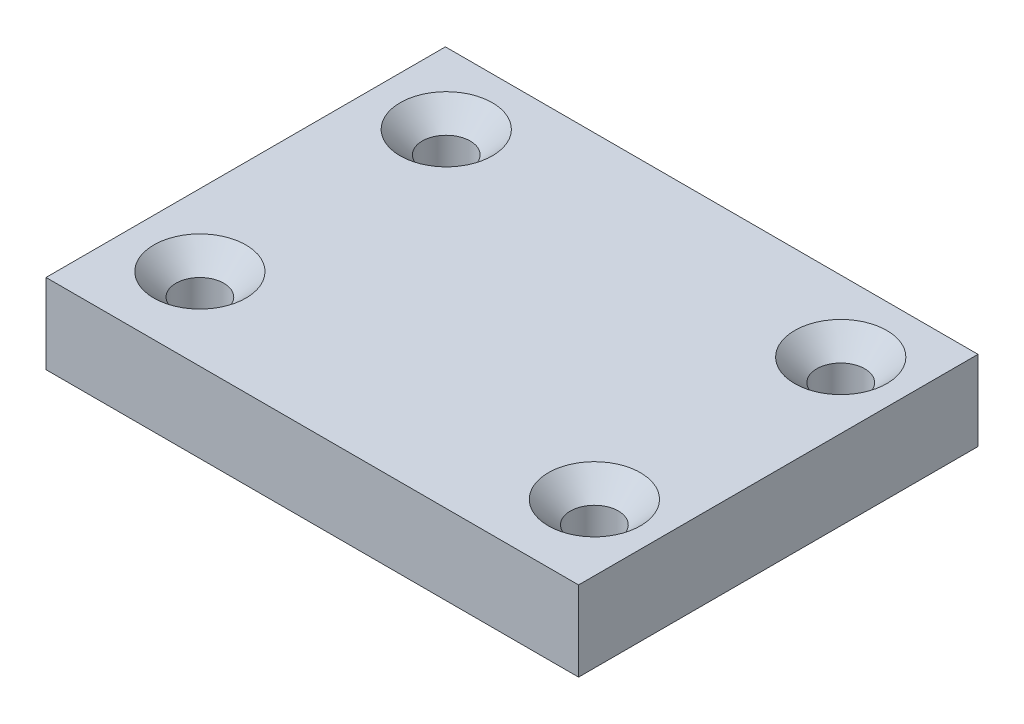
SolidWorks part; units mm, degrees
ref_plane "Front" through (0, 0, 0) normal (0, 0, 1) x (1, 0, 0)
ref_plane "Top" through (0, 0, 0) normal (0, 1, 0) x (1, 0, 0)
ref_plane "Right" through (0, 0, 0) normal (1, 0, 0) x (0, 0, -1)
sketch "Sketch1" plane through (0, 0, 0) normal (0, 1, 0) x (1, 0, 0)
  line L0 (50, -37.5) -> (-50, 37.5) construction
  line L1 (-50, 37.5) -> (50, 37.5)
  line L2 (-50, 37.5) -> (-50, -37.5)
  line L3 (-50, -37.5) -> (50, -37.5)
  line L4 (50, 37.5) -> (50, -37.5)
  dimension "D1" = 100
  dimension "D2" = 75
extrude "Extrude1" add sketch "Sketch1" along normal blind 15
sketch "Sketch6" plane through (0, 15, 0) normal (0, 1, 0) x (-1, 0, 0)
  point P0 (36.5164, -24.1708)
  point P1 (36.5164, 22.0884)
  point P3 (-37.5576, 22.0884)
  point P5 (-37.5576, -24.1708)
hole_wizard "CSK for M8 Flat Head Machine Screw3" positions "Sketch8" profile "Sketch7" countersink size "M8" standard "Ansi Metric"
sketch "Sketch8" plane through (0, 15, 0) normal (0, 1, 0) x (-1, 0, 0)
  point P1 (36.5164, 22.0884)
  point P2 (36.5164, -24.1708)
  point P4 (-37.5576, -24.1708)
  point P6 (-37.5576, 22.0884)
sketch "Sketch7" plane through (-36.5164, 15, 22.0884) normal (1, 0, 0) x (0, 0, 1)
  line L0 (0, 0) -> (0, 15)
  line L1 (0, 15) -> (4.5, 15)
  line L2 (4.5, 15) -> (4.5, 4.15)
  line L3 (4.5, 4.15) -> (8.65, 0)
  line L5 (8.65, 0) -> (0, 0)
  line L6 (-4.5, 4.15) -> (-8.65, 0) construction
  line L11 (0, -6.35) -> (0, 107.95) construction
  dimension "Thru Hole Dia." = 9
  dimension "Thru Hole Depth" = 15
  dimension "Near C'Sink Dia." = 17.3
  dimension "Near C'Sink Angle" = 90
